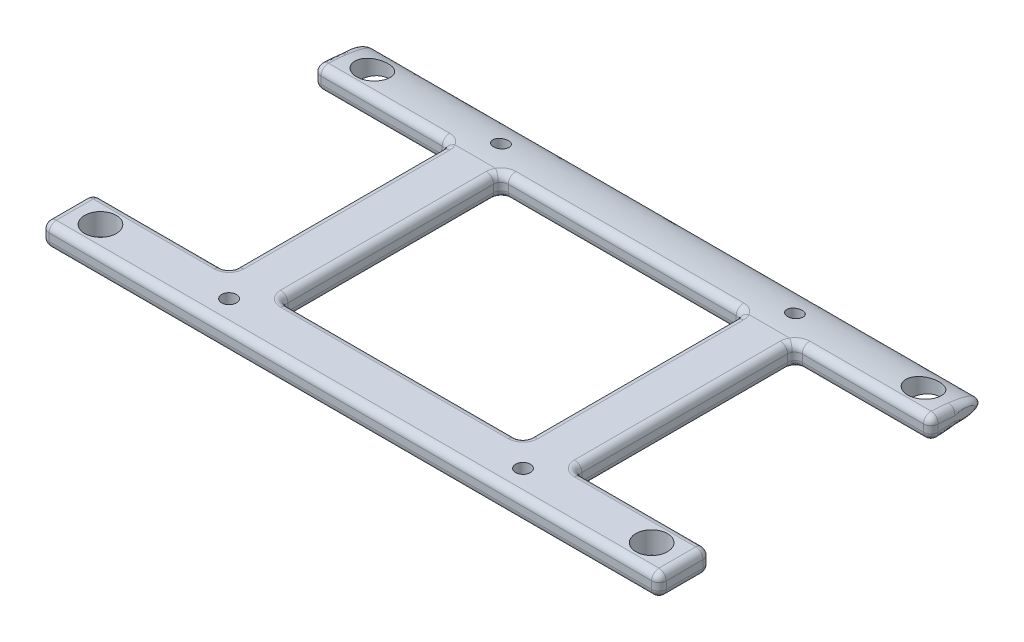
SolidWorks part; units mm, degrees
ref_plane "Front Plane" through (0, 0, 0) normal (0, 0, 1) x (1, 0, 0)
ref_plane "Top Plane" through (0, 0, 0) normal (0, 1, 0) x (1, 0, 0)
ref_plane "Right Plane" through (0, 0, 0) normal (1, 0, 0) x (0, 0, -1)
sketch "Sketch1" plane through (0, 0, 0) normal (0, 1, 0) x (1, 0, 0)
  line L0 (0, 18.5) -> (0, -18.5) construction
  line L1 (42, -18.5) -> (-42, -18.5) construction
  line L2 (42, -18.5) -> (42, 18.5) construction
  line L3 (42, 18.5) -> (-42, 18.5) construction
  line L4 (-42, -18.5) -> (-42, 18.5) construction
  line L5 (42, -18.5) -> (-42, 18.5) construction
  line L6 (42, 18.5) -> (-42, -18.5) construction
  line L7 (-42, 22) -> (42, 22)
  line L8 (42, 22) -> (42, 15)
  line L9 (42, 15) -> (23.5, 15)
  line L10 (23.5, 15) -> (23.5, -15)
  line L11 (23.5, -15) -> (42, -15)
  line L12 (42, -15) -> (42, -22)
  line L13 (42, -22) -> (-42, -22)
  line L14 (-42, -22) -> (-42, -15)
  line L15 (-42, -15) -> (-23.5, -15)
  line L16 (-23.5, -15) -> (-23.5, 15)
  line L17 (-23.5, 15) -> (-42, 15)
  line L18 (-42, 15) -> (-42, 22)
  line L19 (-16.5, 3.5843) -> (-23.5, 3.5843) construction
  line L20 (16.5, -15) -> (-16.5, -15)
  line L21 (16.5, -15) -> (16.5, 15)
  line L22 (16.5, 15) -> (-16.5, 15)
  line L23 (-16.5, -15) -> (-16.5, 15)
  line L24 (16.5, -15) -> (-16.5, 15) construction
  line L25 (16.5, 15) -> (-16.5, -15) construction
  line L26 (20, 18.5) -> (20, -18.5) construction
  circle A0 centre (-20, 18.5) radius 1
  circle A1 centre (20, 18.5) radius 1
  circle A2 centre (20, -18.5) radius 1
  circle A3 centre (-20, -18.5) radius 1
  circle A4 centre (-37.5, 18.5) radius 2.15
  circle A5 centre (-37.5, -18.5) radius 2.15
  circle A6 centre (37.5, -18.5) radius 2.15
  circle A7 centre (37.5, 18.5) radius 2.15
  point P0 (0, 0)
  point P16 (0, 0)
  dimension "D4" = 2
  dimension "D6" = 4.3
  dimension "D1" = 37
  dimension "D2" = 84
  dimension "D3" = 40
  dimension "D5" = 7
  dimension "D7" = 75
extrude "Boss-Extrude1" add sketch "Sketch1" along normal mid plane 3
sketch "Sketch2" plane through (-42, 0, 0) normal (-1, 0, 0) x (0, 0, 1)
  line L0 (-22, 1.5) -> (-22, -1.5) construction
  line L1 (-11.2938, 1.5) -> (-18.7073, 1.5) construction
  line L2 (-22, 0.8) -> (-22, -2.1887) construction
  line L3 (24.2, 0) -> (-24.2, 0) construction
  line L4 (-15, 1.5) -> (-15, 6.5)
  line L5 (-15, 6.5) -> (-27, 6.5)
  line L6 (-27, 6.5) -> (-27, -6.5)
  line L7 (-27, -6.5) -> (-15, -6.5)
  line L8 (-15, -6.5) -> (-15, -1.5)
  line L9 (-23.8514, 0) -> (-13.7946, 0) construction
  line L10 (-22, 1.5) -> (-15, 1.5) construction
  spline S0 degree 3 poles (-22, 0) (-22, 0.9264) (-18.0889, 1.5) (-15, 1.5) knots 0 0 0 0 1 1 1 1
  spline S1 degree 3 poles (-22, 0) (-22, -0.9264) (-18.0889, -1.5) (-15, -1.5) knots 0 0 0 0 1 1 1 1
  dimension "D1" = 5
  dimension "D2" = 5
extrude "Cut-Extrude1" cut sketch "Sketch2" against normal through all both and the other way through all
fillet "Fillet1" radius 1 20 edges at (-42, 0, 15) (-42, 1.5, 18.5) (-42, 0, 22) (-42, -1.5, 18.5) (42, 0, 22) (42, 1.5, 18.5) (42, 0, 15) (42, -1.5, 18.5) (23.5, 0, 15) (-23.5, 0, 15) (-16.5, 0, 15) (16.5, 0, 15)
fillet "Fillet2" radius 1 52 edges at (-41.7071, -1.2071, 15.2929) (41.7071, -1.2071, 15.2929) (-32.75, -1.5, 15) (32.75, -1.5, 15) (-23.7929, -1.5, 14.7071) (23.7929, -1.5, 14.7071) (-23.7929, -1.5, -14.7071) (23.7929, -1.5, -14.7071) (-41.7071, -1.2071, 21.7071) (41.7071, -1.2071, 21.7071) (-41.7071, 1.2071, 21.7071) (41.7071, 1.2071, 21.7071) (-16.2071, -1.5, -14.7071) (-16.2071, -1.5, 14.7071) (16.2071, -1.5, -14.7071) (16.2071, -1.5, 14.7071) (-41.7071, -1.2071, -15) (-42, 0, -15) (-41.7071, 1.2071, -15) (-23.7929, 1.5, -14.7071) (-41.7071, 1.2071, 15.2929) (-32.75, 1.5, 15) (-23.7929, 1.5, 14.7071) (41.7071, 1.2071, 15.2929) (32.75, 1.5, 15) (23.7929, 1.5, 14.7071) (41.7071, -1.2071, -15) (42, 0, -15) (41.7071, 1.2071, -15) (23.7929, 1.5, -14.7071) (-16.2071, 1.5, -14.7071) (-16.2071, 1.5, 14.7071) (0, 1.5, 15) (16.2071, 1.5, 14.7071) (16.2071, 1.5, -14.7071) (0, -1.5, 22) (0, 1.5, 22) (0, -1.5, 15)
